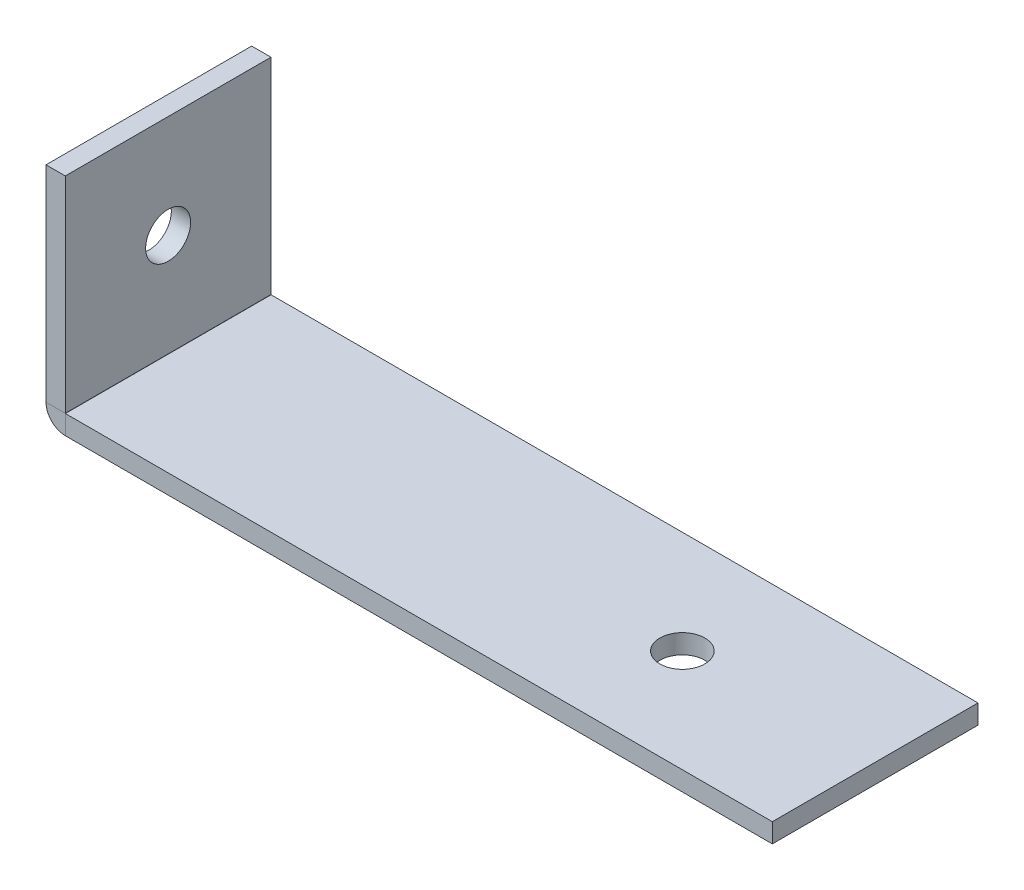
SolidWorks part; units mm, degrees
ref_plane "Front Plane" through (0, 0, 0) normal (0, 0, 1) x (1, 0, 0)
ref_plane "Top Plane" through (0, 0, 0) normal (0, 1, 0) x (1, 0, 0)
ref_plane "Right Plane" through (0, 0, 0) normal (1, 0, 0) x (0, 0, -1)
sketch "Sketch1" plane through (0, 0, 0) normal (0, 1, 0) x (1, 0, 0)
  line L0 (71, 8) -> (0, 8) construction
  line L1 (0, 0) -> (71, 0)
  line L2 (0, 0) -> (0, 16)
  line L3 (0, 16) -> (71, 16)
  line L4 (71, 0) -> (71, 16)
  circle A0 centre (56, 8) radius 1.75
  circle A1 centre (8, 8) radius 1.75
  dimension "D2" = 3.5
  dimension "D3" = 15
  dimension "D4" = 48
  dimension "D1" = 16
  dimension "D5" = 8
sheet metal parameters "Sheet-Metal1" thickness 1.5 parameters "D1"=1
base flange "Base-Flange1" sketch "Sketch1" thickness 1.5 reverse thickness direction yes parameters "D1"=1
sketch "Sketch3" plane through (0, 1.5, 0) normal (0, 1, 0) x (1, 0, 0)
  line L0 (16, 16) -> (16, 0)
  line L1 (71, 16) -> (0, 16) construction
  line L2 (0, 0) -> (71, 0) construction
  line L3 (0, 16) -> (0, 0) construction
  dimension "D1" = 16
sketched bend "Sketched Bend1" parameters "D1"=0.01
bend "SketchBend1" bend radius 0.01 bend angle 90 parameters "D5"=1
flat pattern "Flat-Pattern1"
sketch "Bend-Lines1" plane through (0, 0, 0) normal (0, 1, 0) x (-1, 0, 0)
bend of the flat pattern "Flatten-<SketchBend1>1"
